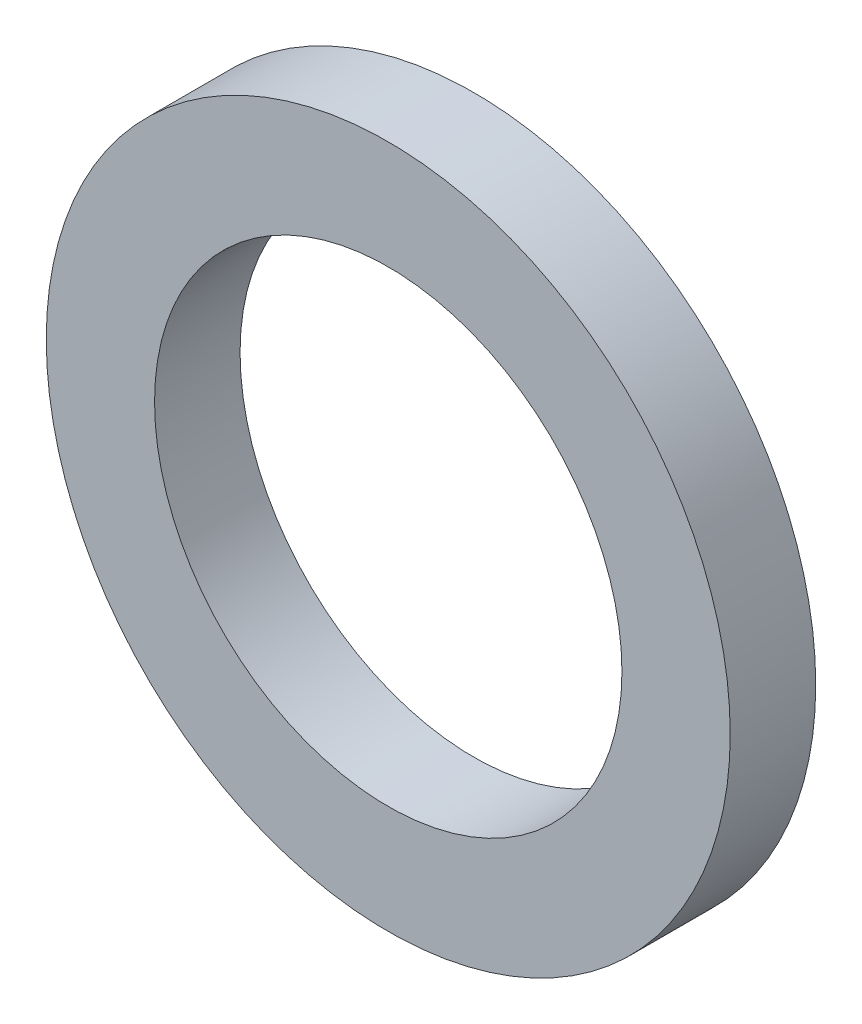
SolidWorks part; units mm, degrees
ref_plane "Plan de face" through (0, 0, 0) normal (0, 0, 1) x (1, 0, 0)
ref_plane "Plan de dessus" through (0, 0, 0) normal (0, 1, 0) x (1, 0, 0)
ref_plane "Plan de droite" through (0, 0, 0) normal (1, 0, 0) x (0, 0, -1)
sketch "Esquisse1" plane through (0, 0, 0) normal (1, 0, 0) x (0, 0, -1)
  line L0 (0, 0) -> (-5.9319, 0) construction
  line L2 (-0.75, 6) -> (0.75, 6)
  line L3 (-0.75, 6) -> (-0.75, 4.1)
  line L4 (-0.75, 4.1) -> (0.75, 4.1)
  line L5 (0.75, 6) -> (0.75, 4.1)
  line L6 (-0.75, 6) -> (0.75, 4.1) construction
  line L7 (-0.75, 4.1) -> (0.75, 6) construction
  point P3 (0, 5.05)
  point P8 (0, 0)
  point P9 (0, 6)
  dimension "D1" = 8.2
  dimension "D2" = 12
  dimension "D3" = 1.5
revolve "Révolution1" add sketch "Esquisse1" angle 360 about L0
